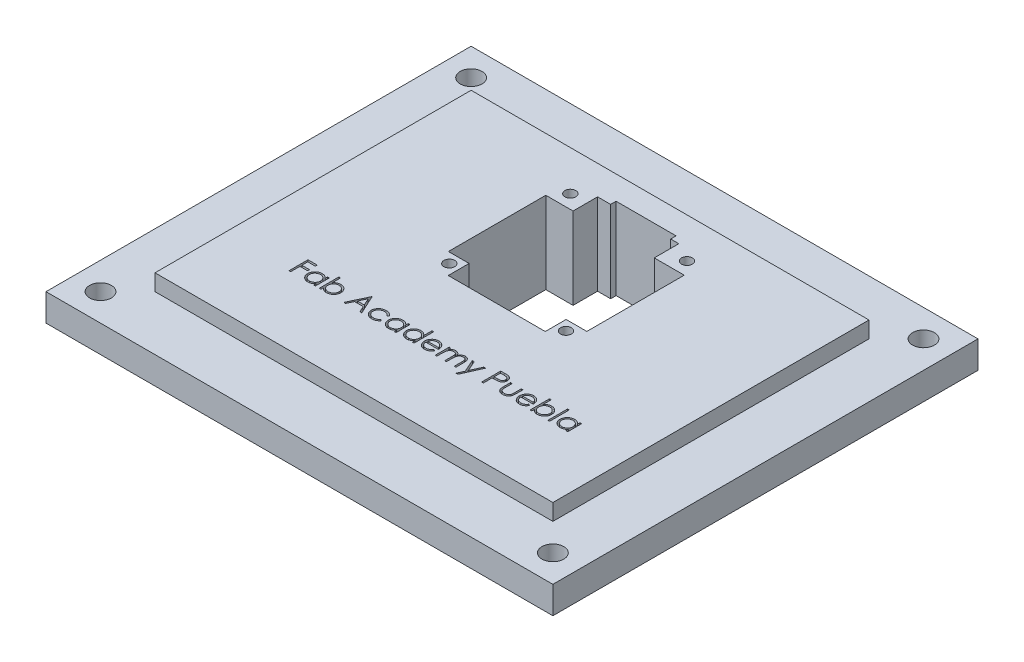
SolidWorks part; units mm, degrees
ref_plane "Front Plane" through (0, 0, 0) normal (0, 0, 1) x (1, 0, 0)
ref_plane "Top Plane" through (0, 0, 0) normal (0, 1, 0) x (1, 0, 0)
ref_plane "Right Plane" through (0, 0, 0) normal (1, 0, 0) x (0, 0, -1)
sketch "Sketch2" plane through (0, 0, 0) normal (0, 1, 0) x (1, 0, 0)
  line L0 (0, 47.9107) -> (0, -30.6329) construction
  line L1 (-12.969, 23.6703) -> (12.431, 23.6703)
  line L2 (-12.969, 23.6703) -> (-12.969, -2.5297)
  line L3 (-12.969, -2.5297) -> (12.431, -2.5297)
  line L4 (12.431, 23.6703) -> (12.431, -2.5297)
  line L5 (-36.5, 29) -> (36.5, 29)
  line L6 (-36.5, 29) -> (-36.5, -29)
  line L7 (-36.5, -29) -> (36.5, -29)
  line L8 (36.5, 29) -> (36.5, -29)
  line L9 (-40.7788, 0) -> (68.7661, 0) construction
  dimension "D1" = 73
  dimension "D2" = 58
extrude "Boss-Extrude1" add sketch "Sketch2" along normal blind 15
sketch "Sketch3" plane through (0, 15, 0) normal (0, 1, 0) x (1, 0, 0)
  line L0 (12.081, 19.1703) -> (-12.619, 19.1703) construction
  line L1 (-12.969, 23.6703) -> (-7.969, 23.6703)
  line L2 (-12.969, 23.6703) -> (-12.969, 19.1703)
  line L3 (-12.969, 19.1703) -> (-7.969, 19.1703)
  line L4 (-7.969, 23.6703) -> (-7.969, 19.1703)
  line L5 (12.431, 23.6703) -> (-12.969, 23.6703) construction
  line L6 (6.931, 23.6703) -> (12.431, 23.6703)
  line L7 (6.931, 23.6703) -> (6.931, 19.1703)
  line L8 (6.931, 19.1703) -> (12.431, 19.1703)
  line L9 (12.431, 23.6703) -> (12.431, 19.1703)
  line L10 (12.431, -2.5297) -> (12.431, 23.6703) construction
  line L12 (12.431, -2.5297) -> (8.631, -2.5297)
  line L13 (12.431, -2.5297) -> (12.431, 1.299)
  line L14 (12.431, 1.299) -> (8.631, 1.299)
  line L15 (8.631, -2.5297) -> (8.631, 1.299)
  line L16 (-12.969, -2.5297) -> (-9.169, -2.5297)
  line L17 (-12.969, -2.5297) -> (-12.969, 1.299)
  line L18 (-12.969, 1.299) -> (-9.169, 1.299)
  line L19 (-9.169, -2.5297) -> (-9.169, 1.299)
  spline S0 degree 3 poles (3.981, 4.6703) (3.981, 3.9649) (3.9621, 3.2596) (3.7857, 1.9275) (3.6588, 1.2995) (3.4319, -0.0136) (3.308, -0.7488) (3.5109, -1.2601) (3.7324, -1.3964) (3.8994, -1.4572) (3.9398, -1.4694) (4.0074, -1.4863) (4.0342, -1.4922) (4.2008, -1.5235) (4.5068, -1.5397) (5.1284, -1.4288) (5.9219, -1.0841) (6.5367, -0.6268) (7.4944, 0.2595) (8.1691, 0.8597) (9.5052, 2.1278) (10.1299, 2.7991) (10.731, 3.4703) knots 0 0 0 0 0.12288 0.12288 0.232107 0.232107 0.352335 0.412449 0.472562 0.472562 0.490846 0.490846 0.502619 0.502619 0.562733 0.622847 0.682961 0.743074 0.743074 0.863981 0.863981 1 1 1 1 weights 1 1 1 1 1 1 1 1 1 1 1 1 1 1 1 1 1 1 1 1 1 1 1 construction
  spline S1 degree 3 poles (-4.519, 4.6703) (-4.519, 3.9649) (-4.5001, 3.2596) (-4.3237, 1.9275) (-4.1968, 1.2995) (-3.9698, -0.0136) (-3.846, -0.7488) (-4.0489, -1.2601) (-4.2704, -1.3964) (-4.4374, -1.4572) (-4.4778, -1.4694) (-4.5454, -1.4863) (-4.5722, -1.4922) (-4.7388, -1.5235) (-5.0448, -1.5397) (-5.6664, -1.4288) (-6.4599, -1.0841) (-7.0747, -0.6268) (-8.0324, 0.2595) (-8.707, 0.8597) (-10.0432, 2.1278) (-10.6679, 2.7991) (-11.269, 3.4703) knots 0 0 0 0 0.12288 0.12288 0.232107 0.232107 0.352335 0.412449 0.472562 0.472562 0.490846 0.490846 0.502619 0.502619 0.562733 0.622847 0.682961 0.743074 0.743074 0.863981 0.863981 1 1 1 1 weights 1 1 1 1 1 1 1 1 1 1 1 1 1 1 1 1 1 1 1 1 1 1 1 construction
  dimension "D1" = 5
  dimension "D2" = 5.5
  dimension "D3" = 4.5
  dimension "D4" = 3.8
  dimension "D5" = 3.8
extrude "Boss-Extrude2" add sketch "Sketch3" against normal blind 15
sketch "Sketch4" plane through (0, 15, 0) normal (0, 1, 0) x (1, 0, 0)
  line L0 (6.931, 23.6703) -> (-7.969, 23.6703) construction
  line L1 (-5.569, 23.6703) -> (5.431, 23.6703)
  line L2 (-5.569, 23.6703) -> (-5.569, 24.6703)
  line L3 (-5.569, 24.6703) -> (5.431, 24.6703)
  line L4 (5.431, 23.6703) -> (5.431, 24.6703)
  line L5 (6.931, 23.6703) -> (6.931, 19.1703) construction
  circle A0 centre (-10.969, 21.6703) radius 1
  circle A1 centre (10.431, 21.6703) radius 1
  circle A2 centre (-10.969, -0.5297) radius 1
  circle A3 centre (10.431, -0.5297) radius 1
  dimension "D4" = 2
  dimension "D5" = 2
  dimension "D6" = 2
  dimension "D7" = 2
  dimension "D1" = 11
  dimension "D2" = 1
  dimension "D3" = 1.5
extrude "Cut-Extrude1" cut sketch "Sketch4" against normal through all
sketch "Sketch5" plane through (0, 15, 0) normal (0, 1, 0) x (1, 0, 0)
  line L0 (36.5, 29) -> (-36.5, 29) construction
  line L1 (-46.5, 39) -> (46.5, 39)
  line L2 (-46.5, 39) -> (-46.5, -39)
  line L3 (-46.5, -39) -> (46.5, -39)
  line L4 (46.5, 39) -> (46.5, -39)
  line L5 (-36.5, 29) -> (-36.5, -29) construction
  line L6 (-36.5, -29) -> (36.5, -29) construction
  line L7 (36.5, -29) -> (36.5, 29) construction
  line L9 (-36.5, 29) -> (36.5, 29)
  line L10 (-36.5, 29) -> (-36.5, -29)
  line L11 (-36.5, -29) -> (36.5, -29)
  line L12 (36.5, 29) -> (36.5, -29)
  circle A0 centre (-41.5, 34) radius 2
  circle A1 centre (41.5, 34) radius 2
  circle A2 centre (41.5, -34) radius 2
  circle A3 centre (-41.5, -34) radius 2
  dimension "D5" = 4
  dimension "D6" = 4
  dimension "D7" = 4
  dimension "D8" = 4
  dimension "D1" = 10
  dimension "D2" = 10
  dimension "D3" = 10
  dimension "D4" = 10
  dimension "D9" = 5
  dimension "D10" = 5
  dimension "D11" = 5
  dimension "D12" = 5
  dimension "D13" = 5
  dimension "D14" = 5
  dimension "D15" = 5
  dimension "D16" = 5
ref_plane "Plane1" through (0, 12, 0) normal (0, 1, 0) x (1, 0, 0)
sketch "Sketch6" plane through (0, 12, 0) normal (0, 1, 0) x (1, 0, 0)
  line L0 (46.5, 39) -> (46.5, -39) construction
  line L1 (-46.5, -39) -> (46.5, -39) construction
  line L2 (-36.5, -29) -> (36.5, -29) construction
  line L3 (-36.5, 29) -> (-36.5, -29) construction
  line L4 (36.5, 29) -> (36.5, -29) construction
  line L5 (-36.5, 29) -> (36.5, 29) construction
  line L6 (-46.5, 39) -> (-46.5, -39) construction
  line L7 (-46.5, 39) -> (46.5, 39) construction
  line L8 (46.5, 39) -> (46.5, -39)
  line L9 (-46.5, -39) -> (46.5, -39)
  line L10 (-36.5, -29) -> (36.5, -29)
  line L11 (-36.5, 29) -> (-36.5, -29)
  line L12 (36.5, 29) -> (36.5, -29)
  line L13 (-36.5, 29) -> (36.5, 29)
  line L14 (-46.5, 39) -> (-46.5, -39)
  line L15 (-46.5, 39) -> (46.5, 39)
  circle A0 centre (41.5, 34) radius 2 construction
  circle A1 centre (41.5, -34) radius 2 construction
  circle A2 centre (-41.5, -34) radius 2 construction
  circle A3 centre (-41.5, 34) radius 2 construction
  circle A4 centre (41.5, 34) radius 2
  circle A5 centre (41.5, -34) radius 2
  circle A6 centre (-41.5, -34) radius 2
  circle A7 centre (-41.5, 34) radius 2
extrude "Boss-Extrude6" add sketch "Sketch6" against normal blind 5
sketch "Sketch7" plane through (0, 15, 0) normal (0, 1, 0) x (1, 0, 0)
  text T0 "Fab Academy Puebla"
extrude "Cut-Extrude2" cut sketch "Sketch7" against normal blind 2
